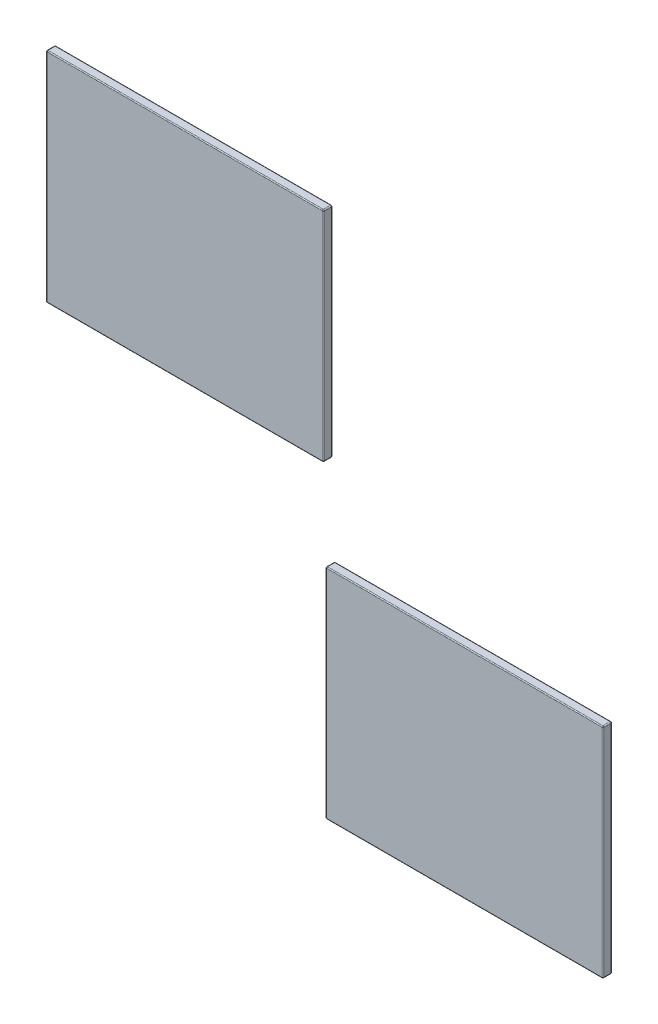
SolidWorks part; units mm, degrees
ref_plane "Plan de face" through (0, 0, 0) normal (0, 0, 1) x (1, 0, 0)
ref_plane "Plan de dessus" through (0, 0, 0) normal (0, 1, 0) x (1, 0, 0)
ref_plane "Plan de droite" through (0, 0, 0) normal (1, 0, 0) x (0, 0, -1)
sketch "Esquisse1" plane through (0, 0, 0) normal (0, 0, 1) x (1, 0, 0)
  line L1 (0, 0) -> (622.5, 0)
  line L2 (0, 0) -> (0, 490)
  line L3 (0, 490) -> (622.5, 490)
  line L4 (622.5, 0) -> (622.5, 490)
  line L5 (-5, 690) -> (-627.5, 690)
  line L6 (-5, 690) -> (-5, 1180)
  line L7 (-5, 1180) -> (-627.5, 1180)
  line L8 (-627.5, 690) -> (-627.5, 1180)
  dimension "D1" = 200
  dimension "D2" = 1250
  dimension "D3" = 5
  dimension "D4" = 1180
extrude "Boss.-Extru.1" add sketch "Esquisse1" against normal blind 20
fillet "Congé1" radius 2.5 4 edges at (-627.5, 690, -10) (-627.5, 1180, -10) (-5, 690, -10) (-5, 1180, -10)
fillet "Congé2" radius 2.5 4 edges at (622.5, 0, -10) (0, 0, -10) (0, 490, -10) (622.5, 490, -10)
fillet "Congé3" radius 2 16 edges at (-5.7322, 690.7322, -20) (-5, 935, -20) (-5.7322, 1179.2678, -20) (-316.25, 1180, -20) (-626.7678, 1179.2678, -20) (-627.5, 935, -20) (-626.7678, 690.7322, -20) (-316.25, 690, -20) (-626.7678, 1179.2678, 0) (-316.25, 1180, 0) (-5.7322, 1179.2678, 0) (-5, 935, 0) (-5.7322, 690.7322, 0) (-316.25, 690, 0) (-626.7678, 690.7322, 0) (-627.5, 935, 0)
fillet "Congé4" radius 2 16 edges at (621.7678, 489.2678, -20) (311.25, 490, -20) (0.7322, 489.2678, -20) (0, 245, -20) (0.7322, 0.7322, -20) (311.25, 0, -20) (621.7678, 0.7322, -20) (622.5, 245, -20) (0.7322, 0.7322, 0) (0, 245, 0) (0.7322, 489.2678, 0) (311.25, 490, 0) (621.7678, 489.2678, 0) (622.5, 245, 0) (621.7678, 0.7322, 0) (311.25, 0, 0)
